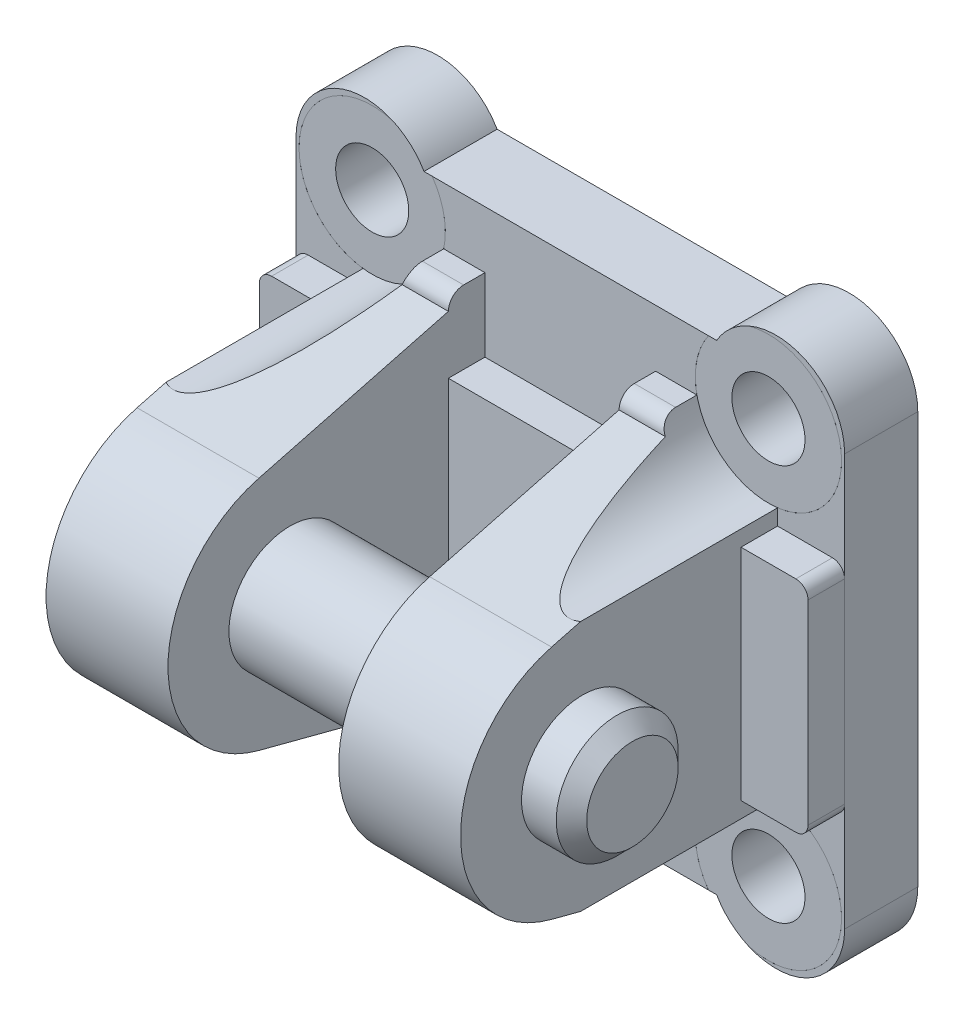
SolidWorks part; units mm, degrees
ref_plane "Vorne" through (0, 0, 0) normal (0, 0, 1) x (1, 0, 0)
ref_plane "Oben" through (0, 0, 0) normal (0, 1, 0) x (1, 0, 0)
ref_plane "Rechts" through (0, 0, 0) normal (1, 0, 0) x (0, 0, -1)
extrude "Basis-Linear austragen" add sketch "Skizze1" along normal blind 6
sketch "Skizze1" plane through (0, 0, 0) normal (0, 0, 1) x (1, 0, 0)
  line L0 (-22.5, 16.875) -> (-22.5, -16.875)
  line L1 (-12.0036, -19.6875) -> (12.0036, -19.6875)
  line L2 (22.5, -16.875) -> (22.5, 16.875)
  line L3 (12.0036, 19.6875) -> (-12.0036, 19.6875)
  arc A0 (-22.5, -16.875) -> (-12.0036, -19.6875) centre (-16.875, -16.875) ccw
  arc A1 (12.0036, -19.6875) -> (22.5, -16.875) centre (16.875, -16.875) ccw
  arc A2 (22.5, 16.875) -> (12.0036, 19.6875) centre (16.875, 16.875) ccw
  arc A3 (-12.0036, 19.6875) -> (-22.5, 16.875) centre (-16.875, 16.875) ccw
extrude "Schnitt-Linear austragen1" cut sketch "Skizze10" along normal blind 5.999
sketch "Skizze10" plane through (0, 0, 0) normal (0, 0, 1) x (1, 0, 0)
  circle A0 centre (0, 0) radius 15
sketch "Skizze2" plane through (0, 0, 0) normal (0, 0, 1) x (1, 0, 0)
  line L0 (-22.499, 8) -> (-22.499, -8)
  line L1 (-21.499, -9) -> (21.499, -9)
  line L2 (22.499, -8) -> (22.499, 8)
  line L3 (21.499, 9) -> (-21.499, 9)
  arc A0 (-22.499, -8) -> (-21.499, -9) centre (-21.499, -8) ccw
  arc A1 (21.499, -9) -> (22.499, -8) centre (21.499, -8) ccw
  arc A2 (22.499, 8) -> (21.499, 9) centre (21.499, 8) ccw
  arc A3 (-21.499, 9) -> (-22.499, 8) centre (-21.499, 8) ccw
ref_plane "Ebene4" through (7, 0, 0) normal (1, 0, 0) x (0, 0, -1)
sketch "Skizze3" plane through (7, 0, 0) normal (1, 0, 0) x (0, 0, -1)
  line L0 (-24.5374, -9.6715) -> (-9, -13.749)
  line L1 (-7.75, -14.999) -> (0, -14.999)
  line L2 (0, -14.999) -> (0, 15.001)
  line L3 (0, 15.001) -> (-7.75, 15.001)
  line L4 (-9, 13.751) -> (-24.5374, 9.6735)
  arc A0 (-24.5374, 9.6735) -> (-24.5374, -9.6715) centre (-21.999, 0.001) ccw
  arc A1 (-9, -13.749) -> (-7.75, -14.999) centre (-7.75, -13.749) ccw
  arc A2 (-7.75, 15.001) -> (-9, 13.751) centre (-7.75, 13.751) ccw
extrude "Aufsatz-Linear austragen1" add sketch "Skizze3" along normal blind 10
ref_plane "Ebene5" through (-7, 0, 0) normal (1, 0, 0) x (0, 0, -1)
sketch "Skizze4" plane through (-7, 0, 0) normal (1, 0, 0) x (0, 0, -1)
  line L0 (-24.5374, -9.6715) -> (-9, -13.749)
  line L1 (-7.75, -14.999) -> (0, -14.999)
  line L2 (0, -14.999) -> (0, 15.001)
  line L3 (0, 15.001) -> (-7.75, 15.001)
  line L4 (-9, 13.751) -> (-24.5374, 9.6735)
  arc A0 (-24.5374, 9.6735) -> (-24.5374, -9.6715) centre (-21.999, 0.001) ccw
  arc A1 (-9, -13.749) -> (-7.75, -14.999) centre (-7.75, -13.749) ccw
  arc A2 (-7.75, 15.001) -> (-9, 13.751) centre (-7.75, 13.751) ccw
extrude "Aufsatz-Linear austragen2" add sketch "Skizze4" against normal blind 10
extrude "Aufsatz-Linear austragen3" add sketch "Skizze2" along normal blind 9
sketch "Skizze5" plane through (0, 0, 0) normal (0, 1, 0) x (1, 0, 0)
  line L0 (-21.0938, -22) -> (-21.0938, -18.25)
  line L1 (-21.0938, -18.25) -> (-19.8438, -17)
  line L2 (-19.8438, -17) -> (19.8438, -17)
  line L3 (19.8438, -17) -> (21.0938, -18.25)
  line L4 (21.0938, -18.25) -> (21.0938, -22)
  line L5 (21.0938, -22) -> (-21.0938, -22)
  line L6 (21.0938, -22) -> (-21.0938, -22) construction
revolve "Aufsatz-Rotationskörper1" add sketch "Skizze5" angle 360 about L6
ref_plane "Ebene6" through (16.25, 0, 0) normal (1, 0, 0) x (0, 0, -1)
sketch "Skizze6" plane through (16.25, 0, 0) normal (1, 0, 0) x (0, 0, -1)
  line L0 (-43.999, -16.25) -> (-43.999, -10.25)
  line L1 (-43.999, -10.25) -> (-5.998, -10.25)
  line L2 (-5.998, -10.25) -> (-5.998, -13.25)
  line L3 (-5.998, -13.25) -> (0.001, -13.25)
  line L4 (0.001, -13.25) -> (0.001, -16.25)
  line L5 (0.001, -16.25) -> (-43.999, -16.25)
  line L6 (0.001, -16.25) -> (-43.999, -16.25) construction
revolve "Schnitt-Rotation1" cut sketch "Skizze6" angle 360 about L6
ref_plane "Ebene7" through (-16.25, 0, 0) normal (1, 0, 0) x (0, 0, -1)
sketch "Skizze7" plane through (-16.25, 0, 0) normal (1, 0, 0) x (0, 0, -1)
  line L0 (-43.999, 16.25) -> (-43.999, 22.25)
  line L1 (-43.999, 22.25) -> (-5.998, 22.25)
  line L2 (-5.998, 22.25) -> (-5.998, 19.25)
  line L3 (-5.998, 19.25) -> (0.001, 19.25)
  line L4 (0.001, 19.25) -> (0.001, 16.25)
  line L5 (0.001, 16.25) -> (-43.999, 16.25)
  line L6 (0.001, 16.25) -> (-43.999, 16.25) construction
revolve "Schnitt-Rotation2" cut sketch "Skizze7" angle 360 about L6
sketch "Skizze8" plane through (-16.25, 0, 0) normal (1, 0, 0) x (0, 0, -1)
  line L0 (-43.999, -16.25) -> (-43.999, -10.25)
  line L1 (-43.999, -10.25) -> (-5.998, -10.25)
  line L2 (-5.998, -10.25) -> (-5.998, -13.25)
  line L3 (-5.998, -13.25) -> (0.001, -13.25)
  line L4 (0.001, -13.25) -> (0.001, -16.25)
  line L5 (0.001, -16.25) -> (-43.999, -16.25)
  line L6 (0.001, -16.25) -> (-43.999, -16.25) construction
revolve "Schnitt-Rotation3" cut sketch "Skizze8" angle 360 about L6
sketch "Skizze9" plane through (16.25, 0, 0) normal (1, 0, 0) x (0, 0, -1)
  line L0 (-43.999, 16.25) -> (-43.999, 22.25)
  line L1 (-43.999, 22.25) -> (-5.998, 22.25)
  line L2 (-5.998, 22.25) -> (-5.998, 19.25)
  line L3 (-5.998, 19.25) -> (0.001, 19.25)
  line L4 (0.001, 19.25) -> (0.001, 16.25)
  line L5 (0.001, 16.25) -> (-43.999, 16.25)
  line L6 (0.001, 16.25) -> (-43.999, 16.25) construction
revolve "Schnitt-Rotation4" cut sketch "Skizze9" angle 360 about L6
